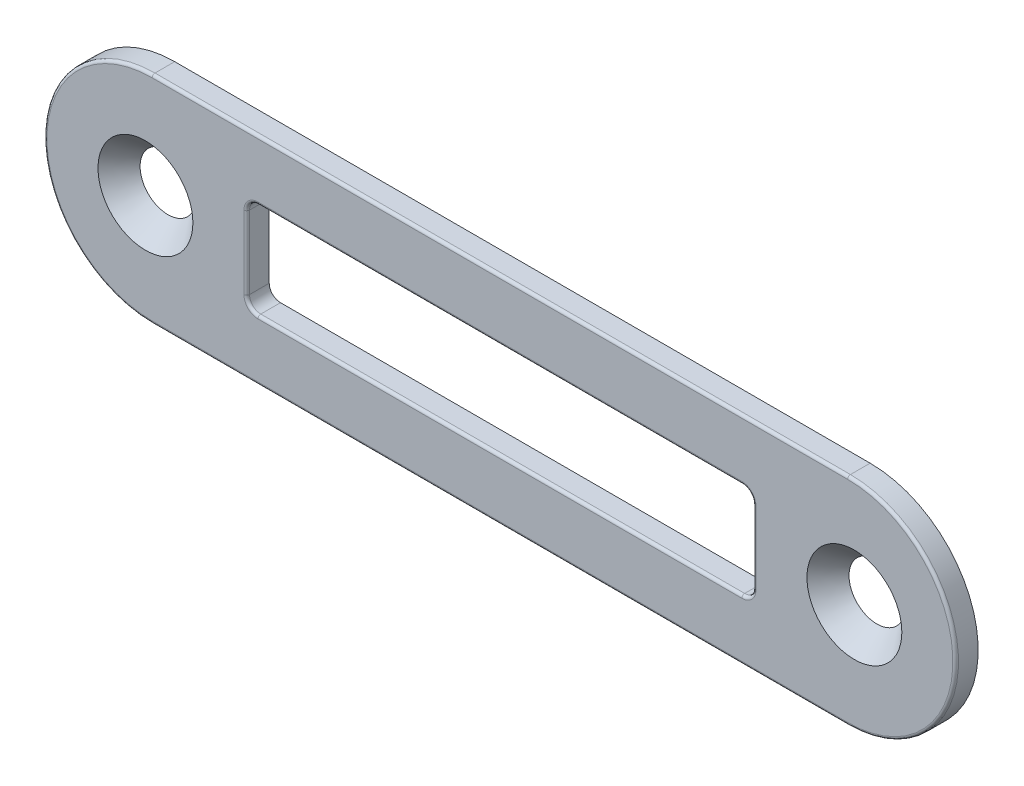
SolidWorks part; units mm, degrees
ref_plane "Plane1" through (0, 0, 0) normal (0, 0, 1) x (1, 0, 0)
ref_plane "Plane2" through (0, 0, 0) normal (0, 1, 0) x (1, 0, 0)
ref_plane "Plane3" through (0, 0, 0) normal (1, 0, 0) x (0, 0, -1)
sketch "Sketch3" plane through (0, 0, 0) normal (0, 0, 1) x (1, 0, 0)
  line L1 (0, 0) -> (61.8, 0)
  line L3 (0, 19.2) -> (61.8, 19.2)
  line L4 (-9.6, 37.6) -> (-9.6, -14.4) construction
  line L6 (71.4, 20.1) -> (71.4, -8.2025) construction
  line L8 (30.9, 19.2) -> (30.9, 0) construction
  arc A0 (61.8, 19.2) -> (61.8, 0) centre (61.8, 9.6) cw
  arc A1 (0, 19.2) -> (0, 0) centre (0, 9.6) ccw
  point P28 (-28.2378, 41.6012)
  dimension "D1" = 9.6
  dimension "D4" = 81
extrude "Base-Extrude" add sketch "Sketch3" along normal blind 2
sketch "Sketch8" plane through (0, 0, 2) normal (0, 0, 1) x (1, 0, 0)
  line L0 (30.9, 19.2) -> (30.9, 0) construction
  line L1 (61.8, 19.2) -> (0, 19.2) construction
  line L2 (0, 0) -> (61.8, 0) construction
  line L4 (8.4, 13.85) -> (53.4, 13.85)
  line L5 (8.4, 13.85) -> (8.4, 5.35)
  line L6 (8.4, 5.35) -> (53.4, 5.35)
  line L7 (53.4, 13.85) -> (53.4, 5.35)
  line L8 (8.4, 13.85) -> (53.4, 5.35) construction
  line L9 (8.4, 5.35) -> (53.4, 13.85) construction
  point P6 (30.9, 9.6)
  dimension "D1" = 45
  dimension "D2" = 8.5
extrude "Cut-Extrude3" cut sketch "Sketch8" against normal through all
sketch "Sketch9" plane through (0, 0, 2) normal (0, 0, 1) x (1, 0, 0)
  line L0 (30.9, 19.2) -> (30.9, 0) construction
  line L1 (61.8, 19.2) -> (0, 19.2) construction
  line L2 (0, 0) -> (61.8, 0) construction
  line L3 (30.9, 9.6) -> (-0.6, 9.6) construction
  line L4 (30.9, 9.6) -> (62.4, 9.6) construction
  circle A0 centre (-0.6, 9.6) radius 2
  circle A1 centre (62.4, 9.6) radius 2
  dimension "D2" = 4
  dimension "D1" = 63
extrude "Cut-Extrude4" cut sketch "Sketch9" against normal through all
hole_wizard "CSK for #8 Flat Head Machine Screw1" positions "Sketch10" profile "Sketch11" countersink size "#8" standard "ANSI Inch"
sketch "Sketch10" plane through (0, 0, 2) normal (0, 0, 1) x (1, 0, 0)
  point P0 (-0.6, 9.6)
  point P3 (62.4, 9.6)
sketch "Sketch11" plane through (-0.6, 9.6, 2) normal (1, 0, 0) x (0, -1, 0)
  line L0 (0, 0) -> (0, 2)
  line L1 (0, 2) -> (2.2479, 2)
  line L2 (2.2479, 2) -> (2.2479, 2.2645)
  line L3 (2.2479, 2.2645) -> (4.2164, 0)
  line L5 (4.2164, 0) -> (0, 0)
  line L6 (-2.2479, 2.2645) -> (-4.2164, 0) construction
  line L11 (0, -6.35) -> (0, 107.95) construction
  dimension "Thru Hole Dia." = 4.4958
  dimension "Thru Hole Depth" = 2
  dimension "Near C'Sink Dia." = 8.4328
  dimension "Near C'Sink Angle" = 82
fillet "Fillet2" radius 1 4 edges at (53.4, 13.85, 1) (53.4, 5.35, 1) (8.4, 5.35, 1) (8.4, 13.85, 1)
fillet "Fillet1" radius 0.25 12 edges at (-9.6, 9.6, 2) (30.9, 19.2, 2) (71.4, 9.6, 2) (30.9, 0, 2) (53.1071, 13.5571, 2) (53.4, 9.6, 2) (53.1071, 5.6429, 2) (30.9, 5.35, 2) (8.6929, 5.6429, 2) (8.4, 9.6, 2) (8.6929, 13.5571, 2) (30.9, 13.85, 2)
